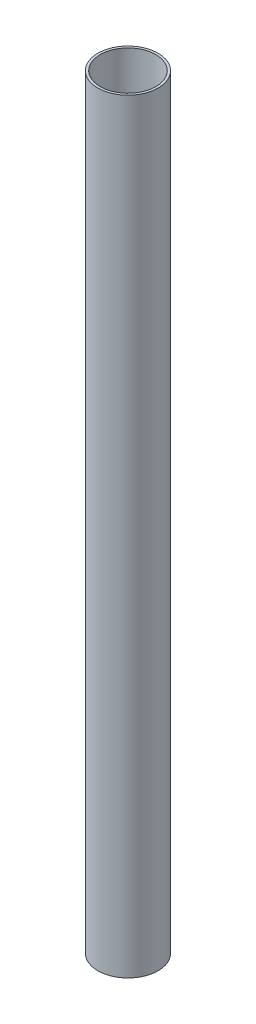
SolidWorks part; units mm, degrees
ref_plane "Front Plane" through (0, 0, 0) normal (0, 0, 1) x (1, 0, 0)
ref_plane "Top Plane" through (0, 0, 0) normal (0, 1, 0) x (1, 0, 0)
ref_plane "Right Plane" through (0, 0, 0) normal (1, 0, 0) x (0, 0, -1)
sketch "Sketch1" plane through (0, 0, 0) normal (0, 1, 0) x (1, 0, 0)
  circle A0 centre (0, 0) radius 13
  circle A1 centre (0, 0) radius 12
  dimension "D1" = 26
  dimension "D2" = 24
extrude "Boss-Extrude1" add sketch "Sketch1" against normal blind 330
